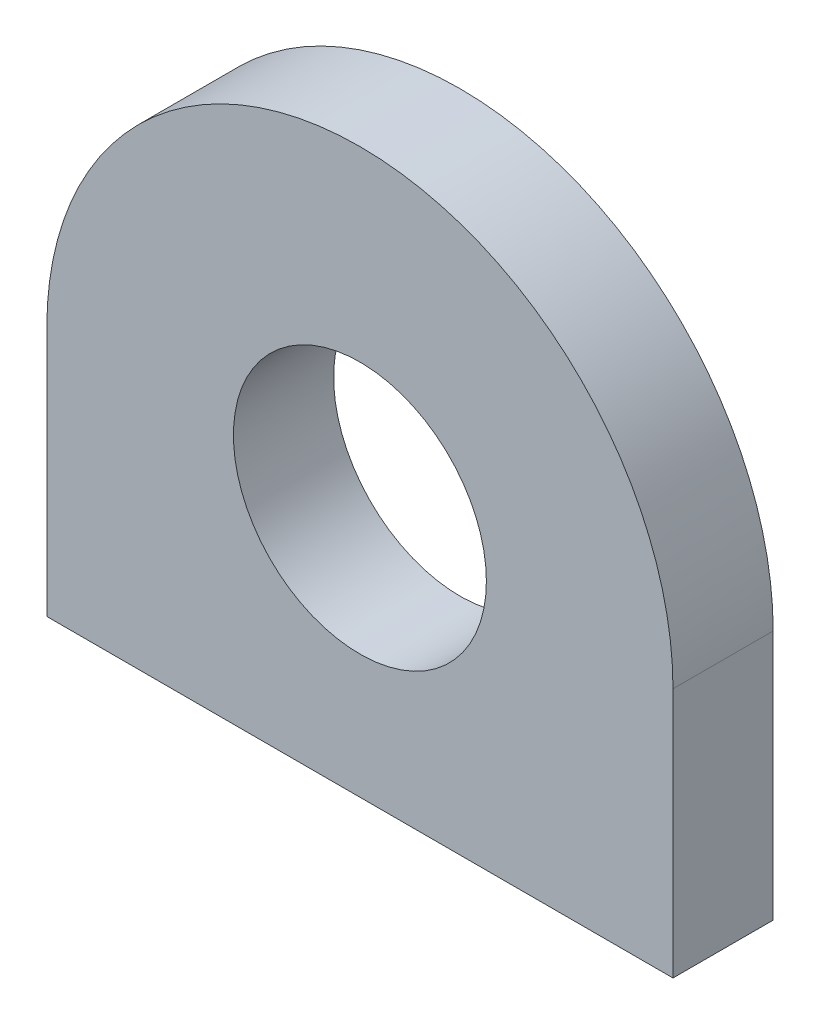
SolidWorks part; units mm, degrees
ref_plane "Plan de face" through (0, 0, 0) normal (0, 0, 1) x (1, 0, 0)
ref_plane "Plan de dessus" through (0, 0, 0) normal (0, 1, 0) x (1, 0, 0)
ref_plane "Plan de droite" through (0, 0, 0) normal (1, 0, 0) x (0, 0, -1)
sketch "Esquisse1" plane through (0, 0, 0) normal (0, 0, 1) x (1, 0, 0)
  line L0 (-25, -20) -> (25, -20)
  line L1 (25, -20) -> (25, 0)
  line L2 (-25, 0) -> (-25, -20)
  circle A0 centre (0, 0) radius 10.1
  arc A1 (25, 0) -> (-25, 0) centre (0, 0) ccw
  dimension "D2" = 20.2
  dimension "D1" = 20
  dimension "D3" = 50
extrude "Extrusion1" add sketch "Esquisse1" along normal blind 8
